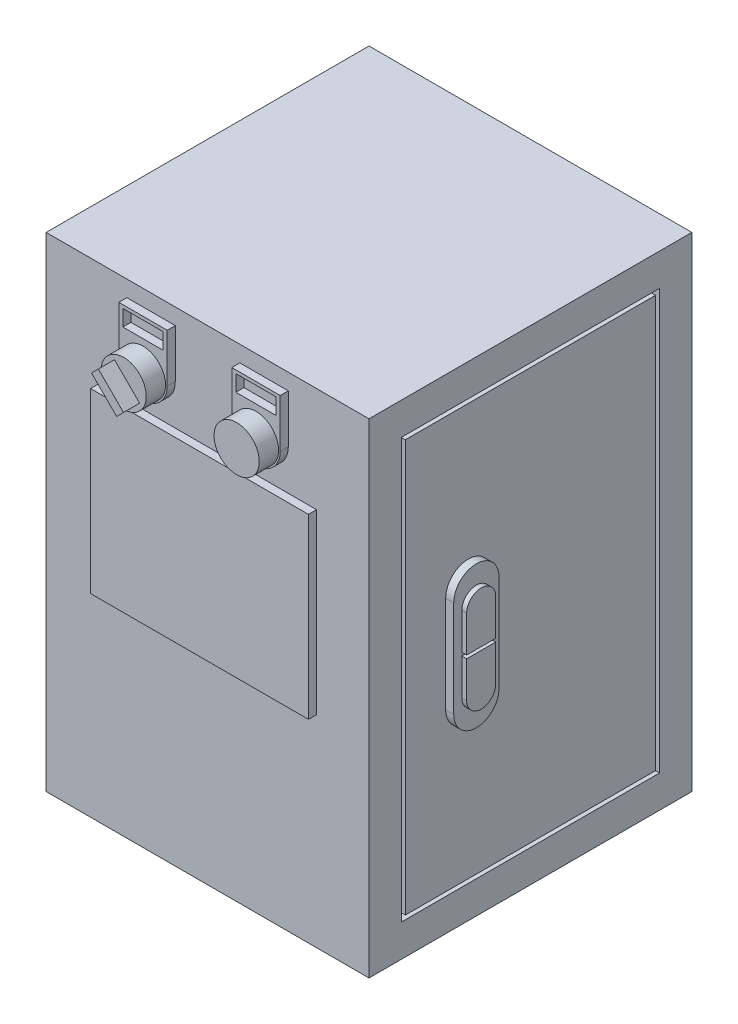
SolidWorks part; units mm, degrees
ref_plane "前视基准面" through (0, 0, 0) normal (0, 0, 1) x (1, 0, 0)
ref_plane "上视基准面" through (0, 0, 0) normal (0, 1, 0) x (1, 0, 0)
ref_plane "右视基准面" through (0, 0, 0) normal (1, 0, 0) x (0, 0, -1)
sketch "草图1" plane through (0, 0, 0) normal (0, 1, 0) x (1, 0, 0)
  line L1 (100, 100) -> (-100, 100)
  line L2 (100, 100) -> (100, -100)
  line L3 (100, -100) -> (-100, -100)
  line L4 (-100, 100) -> (-100, -100)
  line L5 (100, 100) -> (-100, -100) construction
  line L6 (100, -100) -> (-100, 100) construction
  point P0 (0, 0)
  dimension "D1" = 200
  dimension "D2" = 200
extrude "凸台-拉伸1" add sketch "草图1" along normal blind 300
sketch "草图2" plane through (0, 0, 100) normal (0, 0, 1) x (1, 0, 0)
  line L0 (0, 300) -> (0, 260) construction
  line L1 (-100, 300) -> (100, 300) construction
  line L2 (0, 260) -> (35, 260) construction
  line L3 (0, 260) -> (-35, 260) construction
  line L4 (35, 245) -> (35, 290) construction
  line L5 (20, 290) -> (50, 290)
  line L6 (50, 290) -> (50, 260)
  line L7 (20, 290) -> (20, 260)
  line L8 (-47.5, 288) -> (-47.5, 278)
  line L9 (47.5, 288) -> (22.5, 288)
  line L10 (47.5, 288) -> (47.5, 278)
  line L11 (47.5, 278) -> (22.5, 278)
  line L12 (22.5, 288) -> (22.5, 278)
  line L13 (47.5, 288) -> (22.5, 278) construction
  line L14 (47.5, 278) -> (22.5, 288) construction
  line L15 (-47.5, 278) -> (-22.5, 278)
  line L16 (-47.5, 288) -> (-22.5, 288)
  line L17 (-22.5, 288) -> (-22.5, 278)
  line L18 (-20, 290) -> (-50, 290)
  line L19 (-50, 290) -> (-50, 260)
  line L20 (-20, 290) -> (-20, 260)
  arc A0 (20, 260) -> (50, 260) centre (35, 260) ccw
  arc A1 (-20, 260) -> (-50, 260) centre (-35, 260) cw
  point P10 (35, 283)
  dimension "D1" = 2
  dimension "D2" = 10
  dimension "D3" = 25
extrude "凸台-拉伸2" add sketch "草图2" along normal blind 5 separate body
sketch "草图3" plane through (0, 0, 105) normal (0, 0, 1) x (1, 0, 0)
  circle A0 centre (-35, 260) radius 14
  circle A1 centre (35, 260) radius 14
extrude "凸台-拉伸3" add sketch "草图3" along normal blind 12 separate body
sketch "草图4" plane through (0, 0, 117) normal (0, 0, 1) x (1, 0, 0)
  line L0 (-35, 260) -> (-42.7782, 267.7782) construction
  line L1 (-35, 260) -> (-27.2218, 252.2218) construction
  line L2 (-42.7782, 267.7782) -> (-40.6569, 269.8995)
  line L3 (-27.2218, 252.2218) -> (-25.1005, 254.3431)
  line L4 (-42.7782, 267.7782) -> (-44.8995, 265.6569)
  line L5 (-27.2218, 252.2218) -> (-29.3431, 250.1005)
  line L6 (-44.8995, 265.6569) -> (-29.3431, 250.1005)
  line L7 (-40.6569, 269.8995) -> (-25.1005, 254.3431)
extrude "凸台-拉伸4" add sketch "草图4" along normal blind 10 separate body
sketch "草图5" plane through (0, 0, 100) normal (0, 0, 1) x (1, 0, 0)
  line L0 (0, 300) -> (0, 180) construction
  line L1 (-100, 300) -> (100, 300) construction
  line L3 (67.5, 235) -> (-67.5, 235)
  line L4 (67.5, 235) -> (67.5, 125)
  line L5 (67.5, 125) -> (-67.5, 125)
  line L6 (-67.5, 235) -> (-67.5, 125)
  line L7 (67.5, 235) -> (-67.5, 125) construction
  line L8 (67.5, 125) -> (-67.5, 235) construction
  dimension "D1" = 135
  dimension "D2" = 110
extrude "凸台-拉伸5" add sketch "草图5" along normal blind 5 separate body
sketch "草图6" plane through (100, 0, 0) normal (1, 0, 0) x (0, 0, -1)
  line L0 (0, 0) -> (0, 300) construction
  line L1 (-100, 0) -> (100, 0) construction
  line L3 (80, 280) -> (-80, 280)
  line L4 (80, 280) -> (80, 20)
  line L5 (80, 20) -> (-80, 20)
  line L6 (-80, 280) -> (-80, 20)
  line L7 (80, 280) -> (-80, 20) construction
  line L8 (80, 20) -> (-80, 280) construction
  line L9 (77.5, 277.5) -> (-77.5, 277.5)
  line L10 (77.5, 277.5) -> (77.5, 22.5)
  line L11 (77.5, 22.5) -> (-77.5, 22.5)
  line L12 (-77.5, 277.5) -> (-77.5, 22.5)
  line L13 (77.5, 277.5) -> (-77.5, 22.5) construction
  line L14 (77.5, 22.5) -> (-77.5, 277.5) construction
  point P4 (0, 150)
  point P9 (0, 150)
  dimension "D1" = 260
  dimension "D2" = 160
  dimension "D3" = 155
  dimension "D4" = 255
extrude "切除-拉伸1" cut sketch "草图6" against normal blind 10
sketch "草图7" plane through (100, 0, 0) normal (1, 0, 0) x (0, 0, -1)
  line L0 (-77.5, 150) -> (-52.5, 150) construction
  line L1 (-77.5, 277.5) -> (-77.5, 22.5) construction
  line L2 (-52.5, 180) -> (-52.5, 120)
  line L4 (-24.5, 120) -> (-24.5, 180)
  line L6 (-24.5, 150) -> (-29.5, 150) construction
  line L7 (-29.5, 173.5) -> (-29.5, 126.5)
  line L9 (-47.5, 126.5) -> (-47.5, 173.5)
  arc A2 (-29.5, 173.5) -> (-47.5, 173.5) centre (-38.5, 173.5) ccw
  arc A3 (-24.5, 120) -> (-52.5, 120) centre (-38.5, 120) cw
  arc A4 (-24.5, 180) -> (-52.5, 180) centre (-38.5, 180) ccw
  arc A7 (-29.5, 126.5) -> (-47.5, 126.5) centre (-38.5, 126.5) cw
extrude "凸台-拉伸6" add sketch "草图7" along normal blind 5 separate body
sketch "草图8" plane through (100, 0, 0) normal (1, 0, 0) x (0, 0, -1)
  line L0 (-29.5, 126.5) -> (-29.5, 173.5) construction
  line L1 (-47.5, 173.5) -> (-47.5, 126.5) construction
  line L2 (-29.5, 126.5) -> (-29.5, 173.5)
  line L3 (-47.5, 173.5) -> (-47.5, 126.5)
  arc A0 (-47.5, 126.5) -> (-29.5, 126.5) centre (-38.5, 126.5) ccw construction
  arc A1 (-29.5, 173.5) -> (-47.5, 173.5) centre (-38.5, 173.5) ccw construction
  arc A2 (-47.5, 126.5) -> (-29.5, 126.5) centre (-38.5, 126.5) ccw
  arc A3 (-29.5, 173.5) -> (-47.5, 173.5) centre (-38.5, 173.5) ccw
extrude "凸台-拉伸7" add sketch "草图8" along normal blind 8 separate body
sketch "草图9" plane through (108, 0, 0) normal (1, 0, 0) x (0, 0, -1)
  line L0 (-47.5, 150) -> (-29.5, 150) construction
  line L1 (-47.5, 173.5) -> (-47.5, 126.5) construction
  line L3 (-29.5, 151) -> (-47.5, 151)
  line L4 (-29.5, 151) -> (-29.5, 149)
  line L5 (-29.5, 149) -> (-47.5, 149)
  line L6 (-47.5, 151) -> (-47.5, 149)
  line L7 (-29.5, 151) -> (-47.5, 149) construction
  line L8 (-29.5, 149) -> (-47.5, 151) construction
  point P4 (-38.5, 150)
  dimension "D1" = 2
  dimension "D2" = 18
extrude "切除-拉伸2" cut sketch "草图9" against normal blind 3
